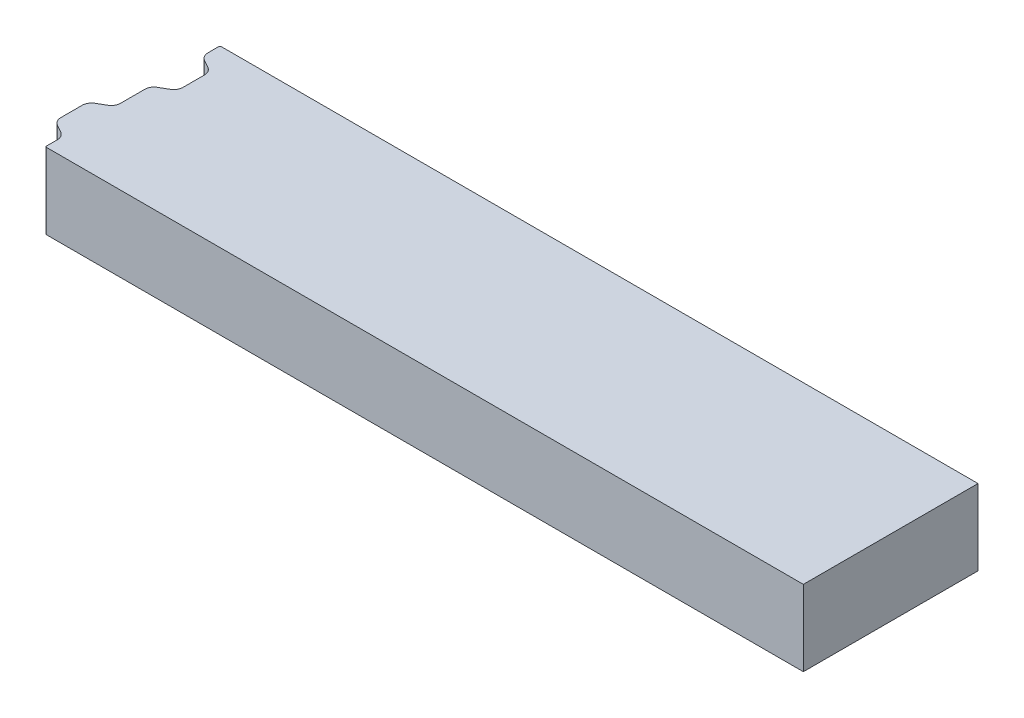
SolidWorks part; units mm, degrees
ref_plane "Face" through (0, 0, 0) normal (0, 0, 1) x (1, 0, 0)
ref_plane "Dessus" through (0, 0, 0) normal (0, 1, 0) x (1, 0, 0)
ref_plane "Droite" through (0, 0, 0) normal (1, 0, 0) x (0, 0, -1)
sketch "Esquisse1" plane through (0, 0, 0) normal (0, 1, 0) x (1, 0, 0)
  line L0 (130.2, 30) -> (130.2, 0)
  line L1 (0, -19.1048) -> (0, 70.5732) construction
  line L19 (0.2, 30) -> (130.2, 30)
  line L20 (0.2, 0) -> (130.2, 0)
  line L21 (1.5, -19.1048) -> (1.5, 42.3436) construction
  line L27 (3, 32.4084) -> (3, -19.1048) construction
  line L32 (0, 29.8) -> (0, 27.9238)
  line L33 (0.8, 26.5381) -> (2.2, 25.7298)
  line L34 (3, 24.3442) -> (3, 20.6604)
  line L35 (2.2022, 19.276) -> (0.7978, 18.4623)
  line L36 (0, 17.0779) -> (0, 12.9221)
  line L37 (0, 0.2) -> (0, 2.0762)
  line L38 (-0.8, 3.4619) -> (-2.2, 4.2702)
  line L39 (-3, 5.6558) -> (-3, 9.3396)
  line L40 (-2.2022, 10.724) -> (-0.7978, 11.5377)
  arc A5 (0, 29.8) -> (0.2, 30) centre (0.2, 29.8) cw
  arc A9 (0, 0.2) -> (0.2, 0) centre (0.2, 0.2) ccw
  arc A16 (0, 27.9238) -> (0.8, 26.5381) centre (1.6, 27.9238) ccw
  arc A17 (2.2, 25.7298) -> (3, 24.3442) centre (1.4, 24.3442) cw
  arc A18 (3, 20.6604) -> (2.2022, 19.276) centre (1.4, 20.6604) cw
  arc A19 (-0.7978, 11.5377) -> (0, 12.9221) centre (-1.6, 12.9221) ccw
  arc A20 (0.7978, 18.4623) -> (0, 17.0779) centre (1.6, 17.0779) ccw
  arc A21 (0, 2.0762) -> (-0.8, 3.4619) centre (-1.6, 2.0762) ccw
  arc A22 (-2.2, 4.2702) -> (-3, 5.6558) centre (-1.4, 5.6558) cw
  arc A23 (-3, 9.3396) -> (-2.2022, 10.724) centre (-1.4, 9.3396) cw
  point P123 (0, 30)
  point P139 (0, 0)
  dimension "D23" = 0.2
  dimension "D3" = 130
  dimension "D15" = 1.5
extrude "Extrusion1" add sketch "Esquisse1" along normal blind 13
